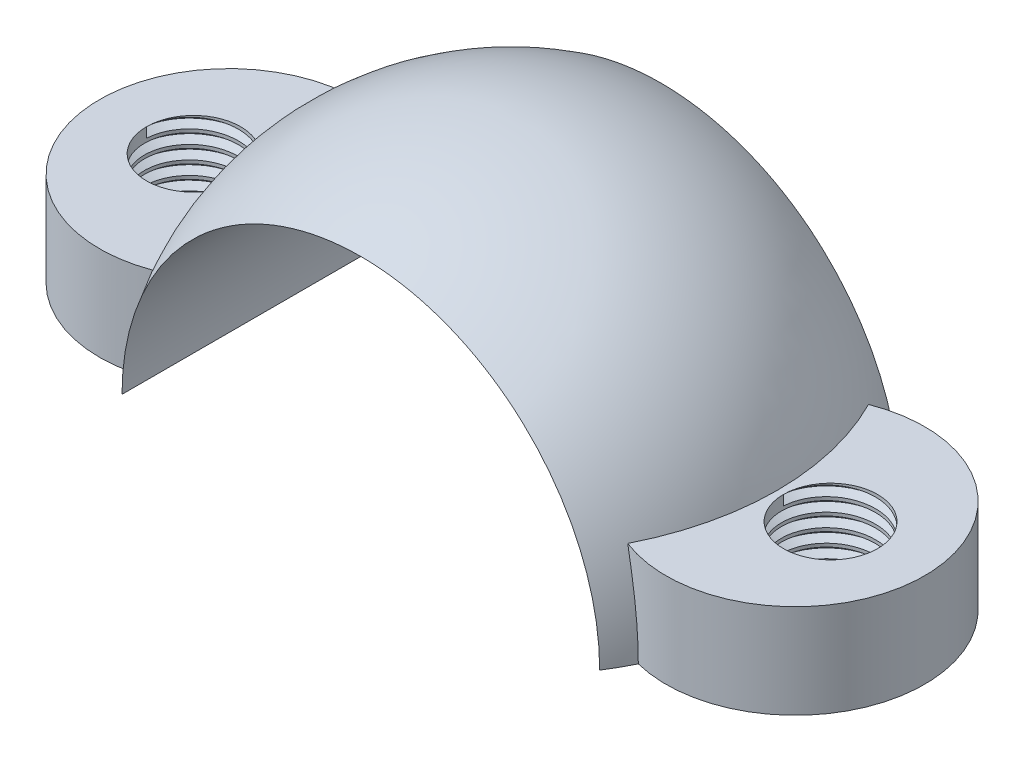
SolidWorks part; units mm, degrees
ref_plane "Front Plane" through (0, 0, 0) normal (0, 0, 1) x (1, 0, 0)
ref_plane "Bottom Plane" through (0, 0, 0) normal (0, 1, 0) x (1, 0, 0)
ref_plane "Right Plane" through (0, 0, 0) normal (1, 0, 0) x (0, 0, -1)
sketch "Sketch2" plane through (0, 0, 0) normal (0, 0, 1) x (1, 0, 0)
  line L0 (0, 19.05) -> (0, -19.05)
  arc A0 (0, 19.05) -> (0, -19.05) centre (0, 0) cw
  dimension "D1" = 19.05
  dimension "D2" = 38.1
revolve "Revolve1" add sketch "Sketch2" angle 360 about L0
sketch "Sketch4" plane through (0, 0, 0) normal (0, 0, 1) x (1, 0, 0)
  line L1 (-19.05, 0) -> (19.1115, 0)
  line L2 (-19.05, 0) -> (-19.05, -19.2599)
  line L3 (-19.05, -19.2599) -> (19.1115, -19.2599)
  line L4 (19.1115, 0) -> (19.1115, -19.2599)
  line L5 (-19.05, 0) -> (19.1115, -19.2599) construction
  line L6 (-19.05, -19.2599) -> (19.1115, 0) construction
  circle A0 centre (0, 0) radius 19.05 construction
  point P4 (0.0307, -9.63)
  dimension "D1" = 0.0307
  dimension "D2" = 9.63
extrude "Cut-Extrude2" cut sketch "Sketch4" along normal mid plane 38.1
sketch "Sketch5" plane through (0, 0, 0) normal (0, 1, 0) x (1, 0, 0)
  circle A0 centre (-19.05, 0) radius 8.7312
  circle A1 centre (0, 0) radius 19.05 construction
  circle A2 centre (19.2001, 0) radius 8.7313
  dimension "D1" = 17.4625
  dimension "D2" = 17.4625
  dimension "D3" = 19.2001
extrude "Boss-Extrude1" add sketch "Sketch5" along normal blind 6.35
sketch "Sketch3" plane through (0, 0, 0) normal (0, 0, 1) x (1, 0, 0)
  circle A0 centre (0, 0) radius 16.129
  dimension "D1" = 32.258
extrude "Cut-Extrude1" cut sketch "Sketch3" against normal mid plane 38.1
sketch "Sketch6" plane through (0, 0, 0) normal (0, 1, 0) x (1, 0, 0)
  line L0 (-27.7812, 0) -> (-21.4312, 0) construction
  line L1 (27.9313, 0) -> (21.5813, 0) construction
  line L2 (19.2001, 0) -> (23.9626, 0)
  line L3 (19.2001, 0) -> (19.2001, -8.7312)
  line L4 (19.2001, -8.7312) -> (23.9626, -8.7312)
  line L5 (23.9626, -8.7312) -> (23.9626, 0)
  arc A0 (-17.0491, 8.4989) -> (-17.0491, -8.4989) centre (-19.05, 0) ccw construction
  arc A2 (17.0653, -8.4663) -> (17.0653, 8.4663) centre (19.2001, 0) ccw construction
  circle A3 centre (-21.4312, 0) radius 3.175
  circle A4 centre (21.5813, 0) radius 3.175
  point P16 (21.5813, 0)
  dimension "D3" = 6.35
  dimension "D4" = 6.35
  dimension "D1" = 6.35
  dimension "D2" = 6.35
  dimension "D5" = 4.7625
extrude "Cut-Extrude3" cut sketch "Sketch6" along normal blind 10.16 contours A3 | A4
thread "Thread1" pitch 0.9071 start angle 0, offset 0, length 6.35, pitch 0.9071, diameter 6.35
ref_plane "Plane1" through (-24.6062, 6.35, 0) normal (0, 0, 1) x (-1, 0, 0)
sketch "Thread Profile1" plane through (-24.6062, 6.35, 0) normal (0, 0, 1) x (-1, 0, 0)
  line L0 (0, 0) -> (0, 0.9071) construction
  line L1 (0, 0) -> (0.491, 0.2835)
  line L2 (0.491, 0.2835) -> (0.491, 0.3969)
  line L3 (0.491, 0.3969) -> (0, 0.6804)
  line L4 (0.491, 0.3402) -> (0, 0.3402) construction
  line L11 (0, 0) -> (0, 0.6804)
  point P2 (0, 0)
  dimension "Pitch" = 0.9071
  dimension "Profile_Angle" = 60
  dimension "Profile_Land" = 0.1134
  dimension "Profile_Height" = 0.491
thread "Thread2" pitch 0.9071 start angle 0, offset 0, length 6.35, pitch 0.9071, diameter 6.35
ref_plane "Plane2" through (18.4063, 6.35, 0) normal (0, 0, 1) x (-1, 0, 0)
sketch "Thread Profile2" plane through (18.4063, 6.35, 0) normal (0, 0, 1) x (-1, 0, 0)
  line L0 (0, 0) -> (0, 0.9071) construction
  line L1 (0, 0) -> (0.491, 0.2835)
  line L2 (0.491, 0.2835) -> (0.491, 0.3969)
  line L3 (0.491, 0.3969) -> (0, 0.6804)
  line L4 (0.491, 0.3402) -> (0, 0.3402) construction
  line L11 (0, 0) -> (0, 0.6804)
  point P2 (0, 0)
  dimension "Pitch" = 0.9071
  dimension "Profile_Angle" = 60
  dimension "Profile_Land" = 0.1134
  dimension "Profile_Height" = 0.491
